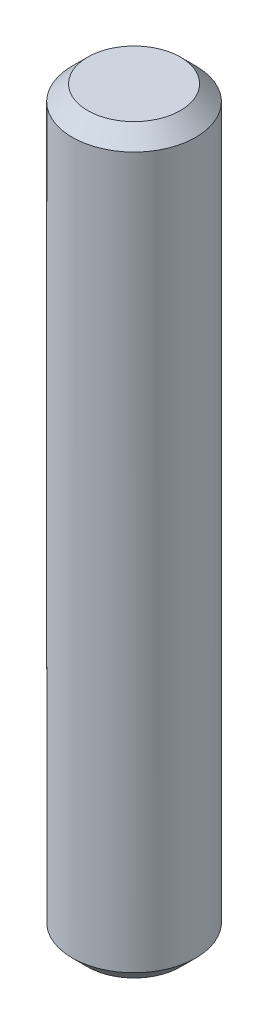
SolidWorks part; units mm, degrees
ref_plane "Front XY" through (0, 0, 0) normal (0, 0, 1) x (1, 0, 0)
ref_plane "Top XZ" through (0, 0, 0) normal (0, 1, 0) x (1, 0, 0)
ref_plane "Right YZ" through (0, 0, 0) normal (1, 0, 0) x (0, 0, -1)
sketch "Sketch1" plane through (0, 0, 0) normal (0, 1, 0) x (1, 0, 0)
  circle A0 centre (0, 0) radius 25.4
  dimension "D1" = 50.8
extrude "Extrude1" add sketch "Sketch1" along normal mid plane 304.8
chamfer "Chamfer1" distance 6.35 angle 45 2 edges at (0, -152.4, 25.4) (0, 152.4, 25.4)
